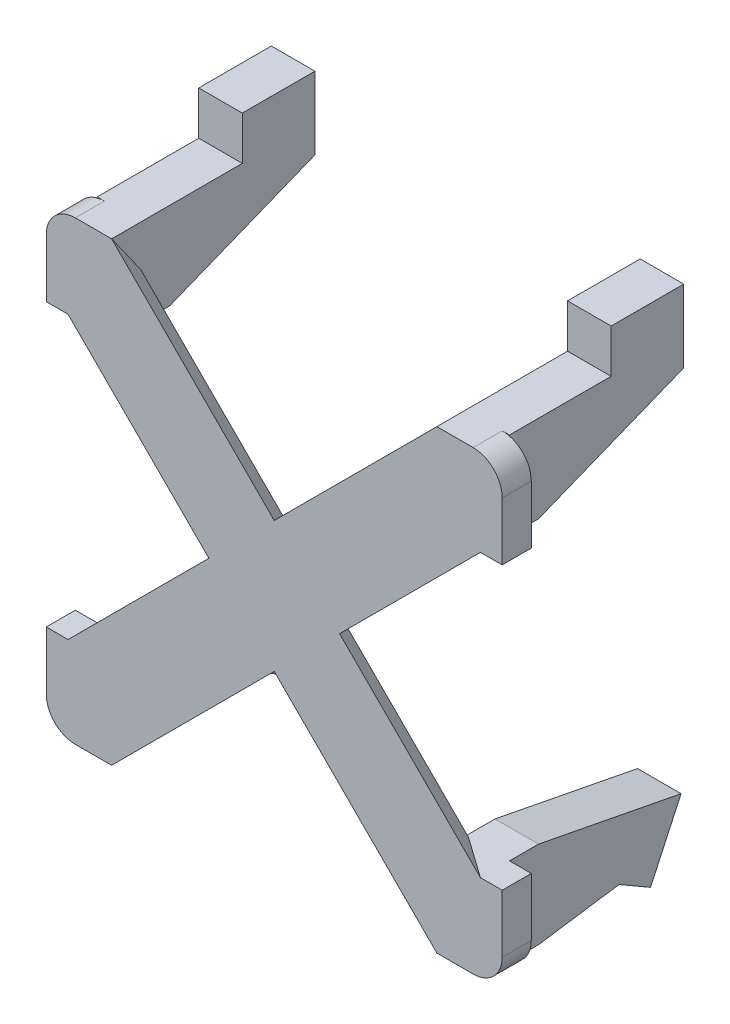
SolidWorks part; units mm, degrees
ref_plane "Front Plane" through (0, 0, 0) normal (0, 0, 1) x (1, 0, 0)
ref_plane "Top Plane" through (0, 0, 0) normal (0, 1, 0) x (1, 0, 0)
ref_plane "Right Plane" through (0, 0, 0) normal (1, 0, 0) x (0, 0, -1)
ref_plane "Plane1" through (-12.7, 0, 0) normal (1, 0, 0) x (0, 0, -1)
sketch "Sketch4" plane through (-12.7, 0, 0) normal (1, 0, 0) x (0, 0, -1)
  line L0 (2, 15.7) -> (7, 15.7)
  line L2 (7, 15.7) -> (7, 18.7)
  line L3 (7, 18.7) -> (12, 18.7)
  line L4 (12, 18.7) -> (12, 13.7)
  line L5 (12, 13.7) -> (2, 9.7)
  line L7 (2, -9.7) -> (11.8174, -11.6025)
  line L8 (11.8174, -11.6025) -> (9.7132, -16.1382)
  line L9 (9.7132, -16.1382) -> (7.5497, -14.8855)
  line L10 (7.5497, -14.8855) -> (2, -15.7)
  line L12 (0, 0) -> (0, 50000) construction
  line L13 (2, -0.5243) -> (2, 49999.4757) construction
  line L14 (0, 0) -> (50000, 0) construction
  line L16 (2, 15.7) -> (0, 15.7)
  line L18 (2, 9.7) -> (0, 9.7)
  line L19 (0, 15.7) -> (0, 9.7)
  line L20 (2, -9.7) -> (0, -9.7)
  line L22 (2, -15.7) -> (0, -15.7)
  line L23 (0, -9.7) -> (0, -15.7)
  point P8 (0, 12.7)
  point P12 (0, -12.7)
  dimension "D1" = 5
  dimension "D2" = 6
  dimension "D3" = 3
  dimension "D4" = 5
  dimension "D5" = 12.7
  dimension "D6" = 12.7
  dimension "D8" = 6
  dimension "D9" = 10
  dimension "D10" = 5
  dimension "D11" = 2.5
  dimension "D12" = 2
extrude "Boss-Extrude2" add sketch "Sketch4" along normal mid plane 3
sketch "Sketch5" plane through (0, 0, 0) normal (0, 0, 1) x (1, 0, 0)
  line L0 (0, 0) -> (-50000, 0) construction
  line L1 (-13.7, 15.7) -> (-11.2, 15.7)
  line L2 (-15.7, 13.7) -> (-15.7, 9.7)
  line L3 (-13.7, -15.7) -> (-11.2, -15.7)
  line L4 (15.7, 13.7) -> (15.7, 9.7)
  line L5 (0, 0) -> (0, 50000) construction
  line L6 (-4.5, 0) -> (-14.2, -9.7)
  line L7 (0, -4.5) -> (11.2, -15.7)
  line L9 (0, -4.5) -> (-11.2, -15.7)
  line L10 (4.5, 0) -> (14.2, -9.7)
  line L19 (-11.2, 15.7) -> (0, 4.5)
  line L20 (-14.2, 9.7) -> (-4.5, 0)
  line L21 (11.2, 15.7) -> (0, 4.5)
  line L22 (14.2, 9.7) -> (4.5, 0)
  line L23 (-14.2, 9.7) -> (-15.7, 9.7)
  line L24 (14.2, 9.7) -> (15.7, 9.7)
  line L25 (-14.2, -9.7) -> (-15.7, -9.7)
  line L26 (14.2, -9.7) -> (15.7, -9.7)
  line L27 (11.2, 15.7) -> (13.7, 15.7)
  line L28 (15.7, -9.7) -> (15.7, -13.7)
  line L29 (11.2, -15.7) -> (13.7, -15.7)
  line L30 (-15.7, -9.7) -> (-15.7, -13.7)
  arc A0 (13.7, 15.7) -> (15.7, 13.7) centre (13.7, 13.7) cw
  arc A1 (13.7, -15.7) -> (15.7, -13.7) centre (13.7, -13.7) ccw
  arc A2 (-15.7, -13.7) -> (-13.7, -15.7) centre (-13.7, -13.7) ccw
  arc A3 (-13.7, 15.7) -> (-15.7, 13.7) centre (-13.7, 13.7) ccw
  dimension "D5" = 2
  dimension "D1" = 15.7
  dimension "D2" = 15.7
  dimension "D3" = 15.7
  dimension "D4" = 15.7
extrude "Boss-Extrude3" add sketch "Sketch5" along normal blind 2 contours L1 A3 L2 L23 L20 L6 L25 L30 A2 L3 L9 L7 L29 A1 L28 L26 L10 L22 L24 L4 A0 L27 L21 L19
mirror "Mirror3" about plane through (0, 0, 0) normal (1, 0, 0) of "Boss-Extrude2"
chamfer "Chamfer1" distance 2 angle 45 8 edges at (-5.6, -10.1, 0) (5.6, -10.1, 0) (9.35, -4.85, 0) (9.35, 4.85, 0) (5.6, 10.1, 0) (-5.6, 10.1, 0) (-9.35, -4.85, 0) (-9.35, 4.85, 0)
